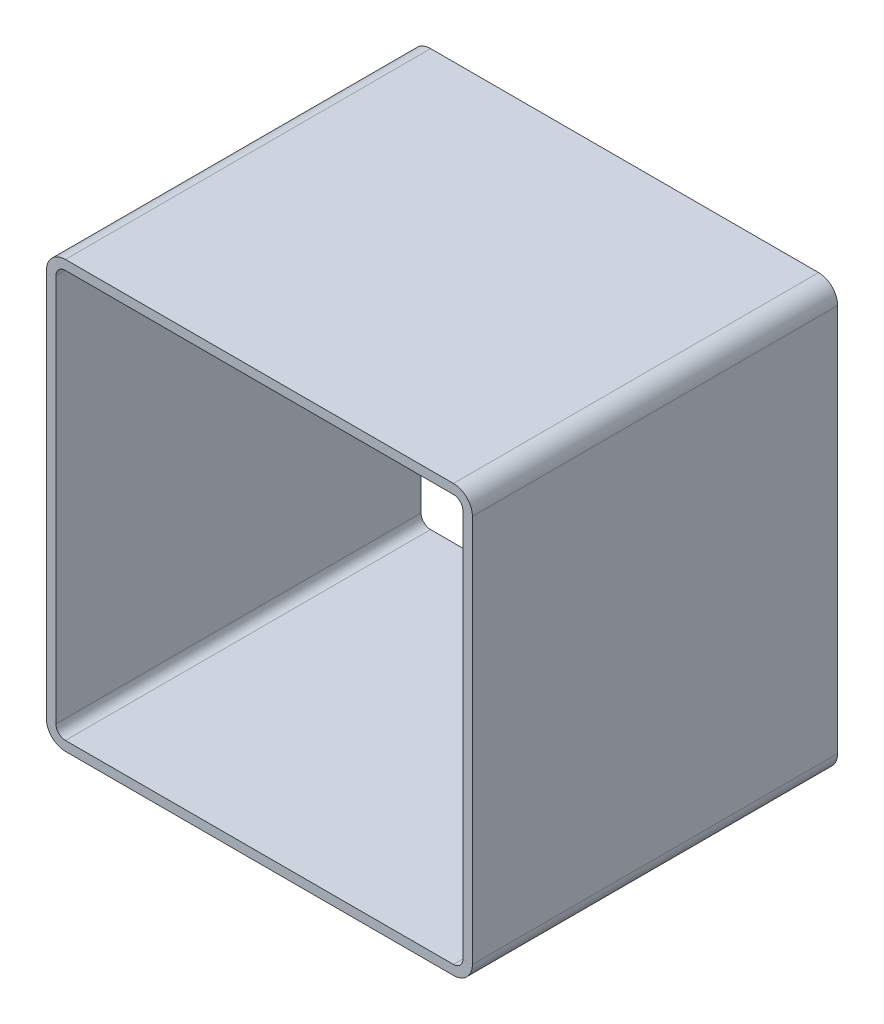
SolidWorks part; units mm, degrees
ref_plane "Front Plane" through (0, 0, 0) normal (0, 0, 1) x (1, 0, 0)
ref_plane "Top Plane" through (0, 0, 0) normal (0, 1, 0) x (1, 0, 0)
ref_plane "Right Plane" through (0, 0, 0) normal (1, 0, 0) x (0, 0, -1)
sketch "Sketch1" plane through (0, 0, 0) normal (0, 0, 1) x (1, 0, 0)
sketch_block_instance "HSS14x14x0.3125-1"
sketch_block "HSS14x14x0.3125"
extrude "Boss-Extrude1" add sketch "Sketch1" along normal blind 304.8
